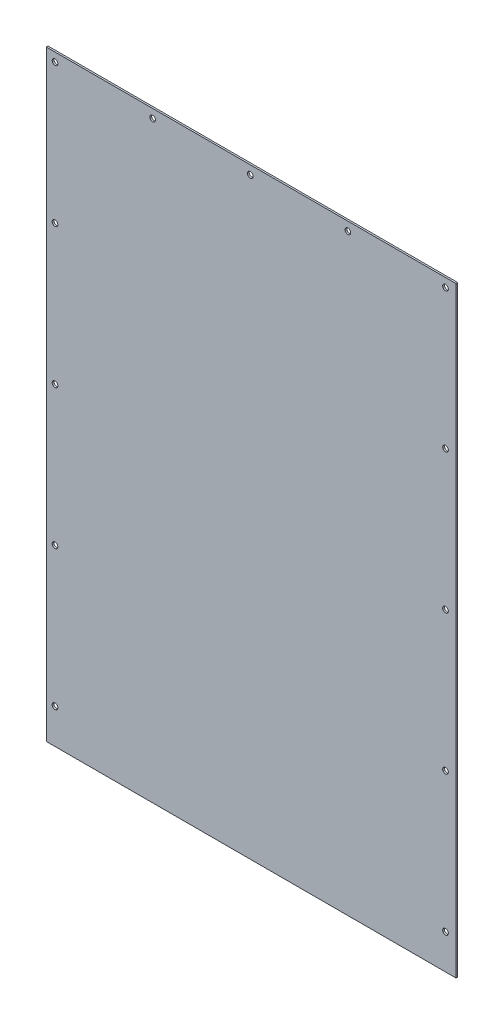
SolidWorks part; units mm, degrees
ref_plane "Plan de face" through (0, 0, 0) normal (0, 0, 1) x (1, 0, 0)
ref_plane "Plan de dessus" through (0, 0, 0) normal (0, 1, 0) x (1, 0, 0)
ref_plane "Plan de droite" through (0, 0, 0) normal (1, 0, 0) x (0, 0, -1)
sketch "Esquisse1" plane through (0, 0, 0) normal (0, 0, 1) x (1, 0, 0)
  line L1 (0, 0) -> (470, 0)
  line L2 (0, 0) -> (0, 690)
  line L3 (0, 690) -> (470, 690)
  line L4 (470, 0) -> (470, 690)
  dimension "D1" = 470
  dimension "D2" = 690
extrude "Boss.-Extru.1" add sketch "Esquisse1" along normal blind 2
sketch "Esquisse2" plane through (0, 0, 2) normal (0, 0, 1) x (1, 0, 0)
  line L0 (470, 690) -> (0, 690) construction
  line L1 (0, 690) -> (0, 0) construction
  circle A0 centre (10, 680) radius 3.25
  dimension "D2" = 10
  dimension "D3" = 6.5
  dimension "D1" = 10
extrude "Enlèv. mat.-Extru.1" cut sketch "Esquisse2" against normal through all
pattern_linear "Répétition linéaire1" count 5 spacing 112 along (1, 0, 0) count 5 spacing 160 along (0, -1, 0) of "Enlèv. mat.-Extru.1"
